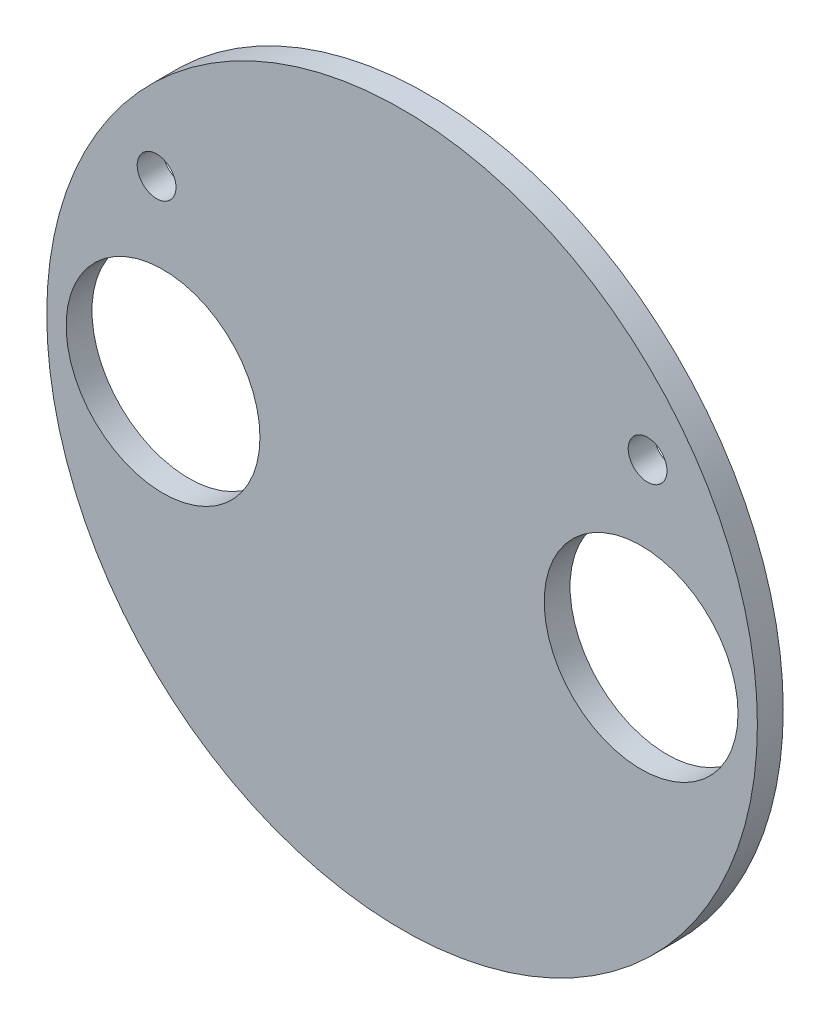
SolidWorks part; units mm, degrees
ref_plane "Face" through (0, 0, 0) normal (0, 0, 1) x (1, 0, 0)
ref_plane "Dessus" through (0, 0, 0) normal (0, 1, 0) x (1, 0, 0)
ref_plane "Droite" through (0, 0, 0) normal (1, 0, 0) x (0, 0, -1)
sketch "Esquisse1" plane through (0, 0, 0) normal (0, 0, 1) x (1, 0, 0)
  circle A0 centre (0, 0) radius 27.5
  dimension "D1" = 55
extrude "Extrusion1" add sketch "Esquisse1" along normal blind 2
sketch "Esquisse2" plane through (0, 0, 2) normal (0, 0, 1) x (1, 0, 0)
  circle A0 centre (-18.5, 0) radius 7.5
  circle A1 centre (-19, 13.5) radius 1.5
  circle A2 centre (18.5, 0) radius 7.5
  circle A3 centre (19, 13.5) radius 1.5
  dimension "D1" = 3
  dimension "D2" = 15
  dimension "D5" = 13.5
  dimension "D6" = 3
  dimension "D7" = 15
  dimension "D3" = 18.5
  dimension "D4" = 19
  dimension "D8" = 18.5
  dimension "D9" = 19
  dimension "D10" = 13.5
extrude "Enlèv. mat.-Extru.1" cut sketch "Esquisse2" against normal through all
